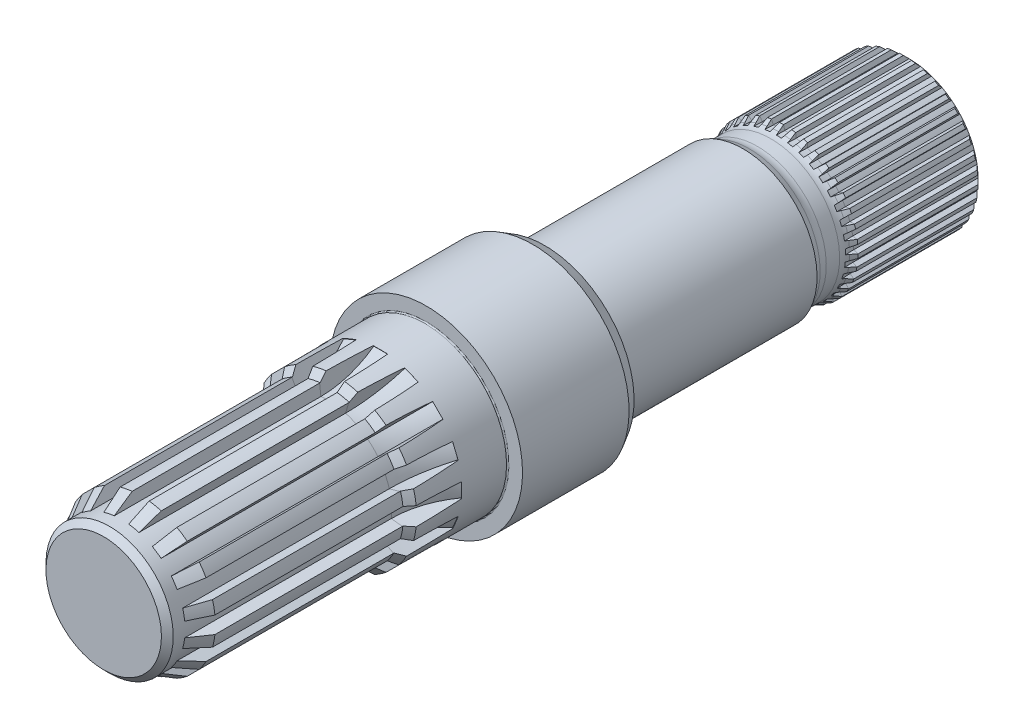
SolidWorks part; units mm, degrees
ref_plane "Plan de face" through (0, 0, 0) normal (0, 0, 1) x (1, 0, 0)
ref_plane "Plan de dessus" through (0, 0, 0) normal (0, 1, 0) x (1, 0, 0)
ref_plane "Plan de droite" through (0, 0, 0) normal (1, 0, 0) x (0, 0, -1)
sketch "Esquisse3" plane through (0, 0, 0) normal (1, 0, 0) x (0, 0, -1)
  line L0 (0, 0) -> (219.9442, 0)
  line L1 (0, 0) -> (0, 19.5)
  line L2 (2, 21.5) -> (6, 21.5)
  line L3 (6, 21.5) -> (12.4952, 25.25)
  line L4 (12.4952, 25.25) -> (76, 25.25)
  line L5 (76, 25.25) -> (78.25, 27.5)
  line L6 (78.25, 27.5) -> (109, 27.5)
  line L7 (109, 27.5) -> (109, 32.5)
  line L8 (109, 32.5) -> (145, 32.5)
  line L9 (149, 30.1906) -> (149, 25)
  line L10 (149, 25) -> (216, 25)
  line L11 (0, 19.5) -> (2, 21.5)
  line L12 (145, 32.5) -> (149, 30.1906)
  line L13 (216, 25) -> (218.1511, 23.904)
  line L14 (220.875, 23.25) -> (225.3703, 23.25)
  line L15 (228.0942, 23.904) -> (230, 24.875)
  line L16 (230, 24.875) -> (272, 24.875)
  line L17 (272, 24.875) -> (272, 8)
  line L18 (272, 8) -> (270.701, 7.25)
  line L19 (270.701, 7.25) -> (262, 7.25)
  line L20 (262, 7.25) -> (262, 6.75)
  line L21 (262, 6.75) -> (224, 6.75)
  line L22 (224, 6.75) -> (219.9442, 0)
  arc A0 (220.875, 23.25) -> (218.1511, 23.904) centre (220.875, 29.25) cw
  arc A1 (228.0942, 23.904) -> (225.3703, 23.25) centre (225.3703, 29.25) cw
  dimension "D19" = 6
  dimension "D1" = 21.5
  dimension "D2" = 30
  dimension "D3" = 6
  dimension "D4" = 25.25
  dimension "D5" = 76
  dimension "D6" = 45
  dimension "D7" = 27.5
  dimension "D8" = 109
  dimension "D9" = 32.5
  dimension "D10" = 149
  dimension "D11" = 25
  dimension "D13" = 30
  dimension "D15" = 27
  dimension "D16" = 27
  dimension "D17" = 23.25
  dimension "D18" = 14
  dimension "D20" = 24.875
  dimension "D21" = 42
  dimension "D22" = 272
  dimension "D23" = 59
  dimension "D24" = 30
  dimension "D25" = 48
  dimension "D26" = 8
  dimension "D27" = 7.25
  dimension "D28" = 6.75
  dimension "D29" = 10
revolve "Révolution1" add sketch "Esquisse3" angle 360 about L0
fillet "Congé1" radius 0.4 1 edges at (0, -27.5, -109)
sketch "Esquisse5" plane through (0, 0, 0) normal (1, 0, 0) x (0, 0, -1)
  line L0 (3.5793, 21.78) -> (75.8045, 21.78)
  line L1 (-12.4397, 0) -> (117.2772, 0) construction
  line L2 (117.2772, 0) -> (117.2772, 0.3082) construction
  line L3 (108.6, 27.5) -> (78.25, 27.5) construction
  arc A0 (75.8045, 21.78) -> (93.425, 27.5) centre (75.8045, 51.78) ccw
  dimension "D1" = 30
  dimension "D2" = 43.56
ref_plane "Plan1" through (0, 0, -3.5793) normal (0, 0, 1) x (1, 0, 0)
sketch "Esquisse6" plane through (0, 0, -3.5793) normal (0, 0, 1) x (1, 0, 0)
  line L0 (-2.435, 21.3617) -> (-4.1601, 36.5028)
  line L1 (-4.1601, 36.5028) -> (4.1601, 36.5028)
  line L2 (4.1601, 36.5028) -> (2.435, 21.3617)
  line L3 (0, -11.3358) -> (0, 36.0024) construction
  circle A0 centre (0, 0) radius 21.5 construction
  arc A1 (2.435, 21.3617) -> (-2.435, 21.3617) centre (0, 0) ccw
  dimension "D1" = 4.87
  dimension "D2" = 6.5
sweep "Enlèvement de matière-Balayage1" cut profiles "Esquisse6" path "Esquisse5"
pattern_circular "Répétition circulaire1" count 16 over 360 about axis through (0, 0, 0) along (0, 0, 1) of "Enlèvement de matière-Balayage1"
sketch "Esquisse7" plane through (0, 0, -272) normal (0, 0, -1) x (-1, 0, 0)
  line L0 (0, -16.4071) -> (0, 32.2845) construction
  line L1 (-15.6663, 14.7051) -> (15.6663, 32.7949) construction
  line L2 (-13.6224, 23.75) -> (16.0983, 23.75) construction
  line L3 (-1.5035, 36.3129) -> (0, 0) construction
  circle A0 centre (0, 0) radius 23.75 construction
  circle A1 centre (0, 0) radius 20.55 construction
  arc A2 (-1.8234, 23.3038) -> (-2.382, 24.7607) centre (264448.197, 101431.2453) cw
  circle A3 centre (0, 0) radius 24.875 construction
  circle A4 centre (0, 0) radius 23.375 construction
  arc A5 (-0.1093, 23.3747) -> (0.327, 24.8729) centre (-271927.9891, 79223.1984) ccw
  arc A6 (0.327, 24.8729) -> (-2.382, 24.7607) centre (0, 0) ccw
  arc A7 (-1.8234, 23.3038) -> (-0.1093, 23.3747) centre (0, 0) cw
  point P7 (0, 23.75)
  point P17 (-1.9633, 23.6687)
  dimension "D1" = 47.5
  dimension "D2" = 30
  dimension "D3" = 41.1
  dimension "D4" = 1.965
  dimension "D5" = 46.75
sketch "Esquisse9" plane through (0, 0, -272) normal (0, 0, -1) x (-1, 0, 0)
  line L0 (-1.5035, 36.3129) -> (0, 0) construction
  line L1 (-1.5035, 36.3129) -> (0, 0)
  arc A0 (-0.1093, 23.3747) -> (-1.8234, 23.3038) centre (0, 0) ccw construction
  arc A1 (-0.1093, 23.3747) -> (-1.8234, 23.3038) centre (0, 0) ccw
  point P2 (-0.967, 23.355)
ref_plane "Plan2" through (0, 0, 0) normal (0.9991, -0.0414, 0) x (0, 0, -1)
sketch "Esquisse10" plane through (0, 0, 0) normal (0.9991, -0.0414, 0) x (0, 0, -1)
  line L0 (272, 23.75) -> (230, 23.75)
  line L10 (272, 0) -> (230, 0) construction
  line L11 (272, 23.3592) -> (272, 24.838) construction
  arc A0 (230, 23.75) -> (217.2866, 26.4295) centre (230, 55.25) cw
  dimension "D1" = 31.5
  dimension "D2" = 23.75
  dimension "D3" = 42
sweep "Enlèvement de matière-Balayage2" cut profiles "Esquisse7" path "Esquisse10"
pattern_circular "Répétition circulaire2" count 38 over 360 about axis through (0, 0, 0) along (0, 0, 1) of "Enlèvement de matière-Balayage2"
chamfer "Chanfrein2" distance 1.5 angle 45 38 edges at (7.0988, 23.8406, -272) (10.926, 22.347, -272) (14.4552, 20.2439, -272) (17.59, 17.5885, -272) (20.2451, 14.4534, -272) (22.348, 10.924, -272) (23.8412, 7.0967, -272) (24.6841, 3.0758, -272) (24.8537, -1.029, -272) (24.3454, -5.1058, -272) (23.1729, -9.0433, -272) (21.3684, -12.7341, -272) (18.981, -16.0775, -272) (16.0759, -18.9824, -272) (12.7322, -21.3695, -272) (9.0413, -23.1737, -272) (5.1037, -24.3458, -272) (1.0269, -24.8538, -272) (-3.0779, -24.6838, -272) (-7.0988, -23.8406, -272) (-10.926, -22.347, -272) (-14.4552, -20.2439, -272) (-17.59, -17.5885, -272) (-20.2451, -14.4534, -272) (-22.348, -10.924, -272) (-23.8412, -7.0967, -272) (-24.6841, -3.0758, -272) (-24.8537, 1.029, -272) (-24.3454, 5.1058, -272) (-23.1729, 9.0433, -272) (-21.3684, 12.7341, -272) (-18.981, 16.0775, -272) (-16.0759, 18.9824, -272) (-12.7322, 21.3695, -272) (-9.0413, 23.1737, -272) (-5.1037, 24.3458, -272) (-1.0269, 24.8538, -272) (3.0779, 24.6838, -272)
fillet "Congé2" radius 0.4 1 edges at (0, -25, -149)
